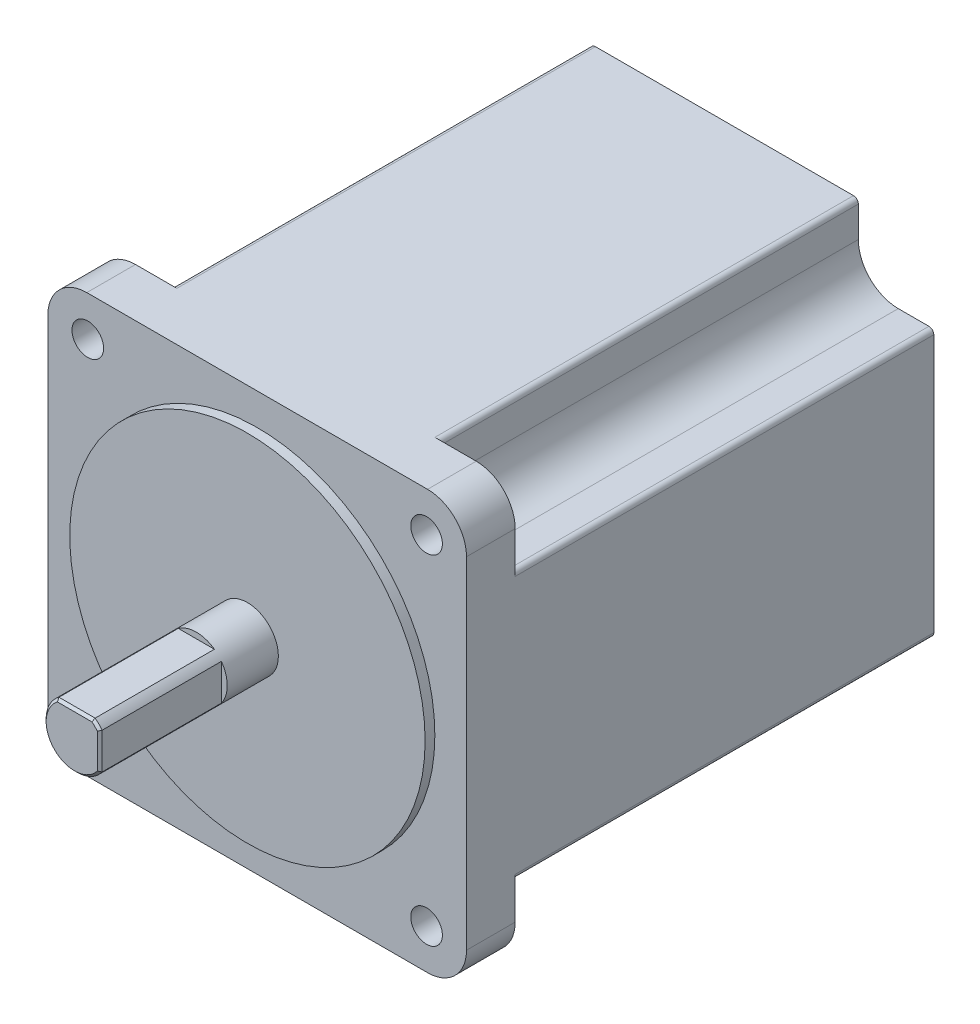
SolidWorks part; units mm, degrees
ref_plane "前视基准面" through (0, 0, 0) normal (0, 0, 1) x (1, 0, 0)
ref_plane "上视基准面" through (0, 0, 0) normal (0, 1, 0) x (1, 0, 0)
ref_plane "右视基准面" through (0, 0, 0) normal (1, 0, 0) x (0, 0, -1)
sketch "草图1" plane through (0, 0, 0) normal (0, 0, 1) x (1, 0, 0)
  circle A0 centre (0, 0) radius 36.5
extrude "凸台-拉伸1" add sketch "草图1" against normal blind 2
sketch "草图2" plane through (0, 0, 0) normal (0, 0, 1) x (1, 0, 0)
  circle A0 centre (0, 0) radius 6.35
extrude "凸台-拉伸2" add sketch "草图2" along normal blind 35.5
sketch "草图3" plane through (0, 0, 35.5) normal (0, 0, 1) x (1, 0, 0)
  line L1 (0, 5.15) -> (4.7381, 5.15)
  line L2 (4.7381, 5.15) -> (4.7381, 8.7654)
  line L3 (4.7381, 8.7654) -> (-5.4014, 8.7654)
  line L4 (-5.4014, 8.7654) -> (-5.4014, 5.15)
  line L5 (-5.4014, 5.15) -> (0, 5.15)
  line L7 (5.15, 0) -> (5.15, -5.0697)
  line L8 (5.15, -5.0697) -> (9.1919, -5.0697)
  line L9 (9.1919, -5.0697) -> (9.1919, 4.4064)
  line L10 (9.1919, 4.4064) -> (5.15, 4.4064)
  line L11 (5.15, 4.4064) -> (5.15, 0)
extrude "切除-拉伸1" cut sketch "草图3" against normal blind 25
sketch "草图4" plane through (0, 0, -2) normal (0, 0, -1) x (-1, 0, 0)
  line L1 (0, 43) -> (35, 43)
  line L2 (43, 35) -> (43, -35)
  line L3 (35, -43) -> (-35, -43)
  line L4 (-43, -35) -> (-43, 35)
  line L5 (-35, 43) -> (0, 43)
  arc A0 (-35, -43) -> (-43, -35) centre (-35, -35) cw
  arc A1 (43, -35) -> (35, -43) centre (35, -35) cw
  arc A2 (35, 43) -> (43, 35) centre (35, 35) cw
  arc A3 (-43, 35) -> (-35, 43) centre (-35, 35) cw
  circle A4 centre (-34.8, 34.8) radius 3.25
  circle A5 centre (34.8, 34.8) radius 3.25
  circle A6 centre (34.8, -34.8) radius 3.25
  circle A7 centre (-34.8, -34.8) radius 3.25
  dimension "D1" = 8
extrude "凸台-拉伸3" add sketch "草图4" along normal blind 96
sketch "草图5" plane through (0, 0, -98) normal (0, 0, -1) x (-1, 0, 0)
  line L1 (35, 43) -> (-35, 43) construction
  line L2 (13.75, 43) -> (26.5, 43)
  line L3 (27.5, 42) -> (27.5, 35.7)
  line L4 (35.7, 27.5) -> (42, 27.5)
  line L5 (43, -35) -> (43, 35) construction
  line L6 (43, 26.5) -> (43, 18.141)
  line L7 (43, 18.141) -> (50.5715, 18.141)
  line L8 (50.5715, 18.141) -> (50.5715, 56.8276)
  line L9 (50.5715, 56.8276) -> (13.75, 56.8276)
  line L10 (13.75, 56.8276) -> (13.75, 43)
  line L12 (-13.75, 56.8276) -> (-13.75, 43)
  line L13 (-50.5715, 56.8276) -> (-13.75, 56.8276)
  line L14 (-50.5715, 18.141) -> (-50.5715, 56.8276)
  line L15 (-43, 18.141) -> (-50.5715, 18.141)
  line L16 (-43, 26.5) -> (-43, 18.141)
  line L17 (-35.7, 27.5) -> (-42, 27.5)
  line L18 (-27.5, 42) -> (-27.5, 35.7)
  line L19 (-13.75, 43) -> (-26.5, 43)
  line L20 (13.75, -56.8276) -> (13.75, -43)
  line L21 (50.5715, -56.8276) -> (13.75, -56.8276)
  line L22 (50.5715, -18.141) -> (50.5715, -56.8276)
  line L23 (43, -18.141) -> (50.5715, -18.141)
  line L24 (43, -26.5) -> (43, -18.141)
  line L25 (35.7, -27.5) -> (42, -27.5)
  line L26 (27.5, -42) -> (27.5, -35.7)
  line L27 (13.75, -43) -> (26.5, -43)
  line L28 (-13.75, -43) -> (-26.5, -43)
  line L29 (-27.5, -42) -> (-27.5, -35.7)
  line L30 (-35.7, -27.5) -> (-42, -27.5)
  line L31 (-43, -26.5) -> (-43, -18.141)
  line L32 (-43, -18.141) -> (-50.5715, -18.141)
  line L33 (-50.5715, -18.141) -> (-50.5715, -56.8276)
  line L34 (-50.5715, -56.8276) -> (-13.75, -56.8276)
  line L35 (-13.75, -56.8276) -> (-13.75, -43)
  arc A0 (27.5, 35.7) -> (35.7, 27.5) centre (35.7, 35.7) ccw
  arc A1 (42, 27.5) -> (43, 26.5) centre (42, 26.5) cw
  arc A2 (26.5, 43) -> (27.5, 42) centre (26.5, 42) cw
  arc A3 (-26.5, 43) -> (-27.5, 42) centre (-26.5, 42) ccw
  arc A4 (-42, 27.5) -> (-43, 26.5) centre (-42, 26.5) ccw
  arc A5 (-27.5, 35.7) -> (-35.7, 27.5) centre (-35.7, 35.7) cw
  arc A6 (26.5, -43) -> (27.5, -42) centre (26.5, -42) ccw
  arc A7 (42, -27.5) -> (43, -26.5) centre (42, -26.5) ccw
  arc A8 (27.5, -35.7) -> (35.7, -27.5) centre (35.7, -35.7) cw
  arc A9 (-27.5, -35.7) -> (-35.7, -27.5) centre (-35.7, -35.7) ccw
  arc A10 (-42, -27.5) -> (-43, -26.5) centre (-42, -26.5) cw
  arc A11 (-26.5, -43) -> (-27.5, -42) centre (-26.5, -42) cw
  point P19 (43, 27.5)
  point P22 (27.5, 43)
  point P38 (-27.5, 43)
  point P39 (-43, 27.5)
  point P54 (27.5, -43)
  point P55 (43, -27.5)
  point P70 (-43, -27.5)
  point P71 (-27.5, -43)
  dimension "D1" = 8.2
  dimension "D2" = 1
extrude "切除-拉伸2" cut sketch "草图5" against normal blind 86
chamfer "倒角1" distance 0.5 angle 45 4 edges at (4.4901, 4.4901, 35.5) (-4.4901, -4.4901, 35.5) (0, 5.15, 35.5) (5.15, 0, 35.5)
